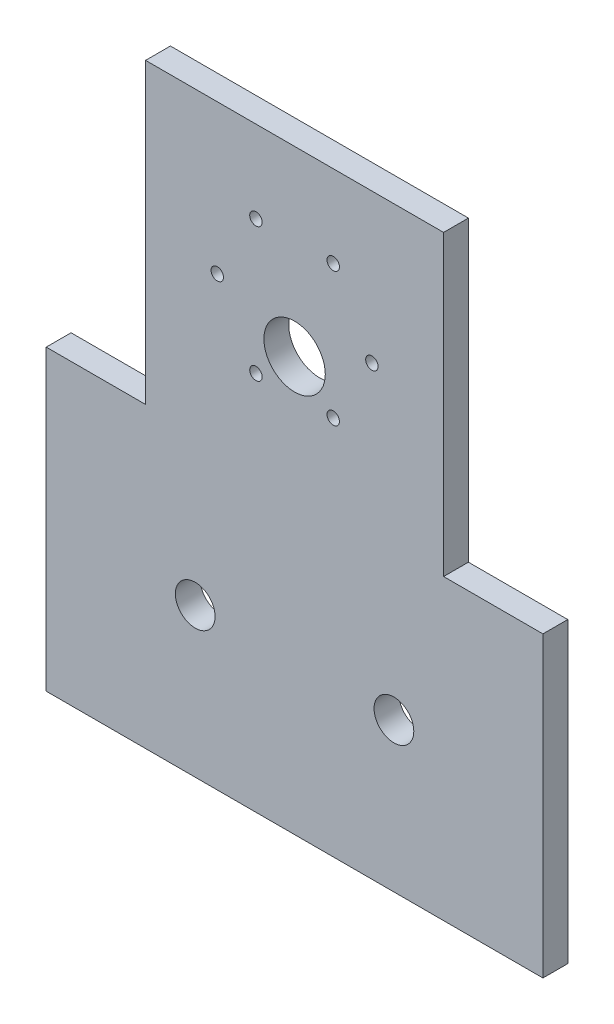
SolidWorks part; units mm, degrees
ref_plane "Front Plane" through (0, 0, 0) normal (0, 0, 1) x (1, 0, 0)
ref_plane "Top Plane" through (0, 0, 0) normal (0, 1, 0) x (1, 0, 0)
ref_plane "Right Plane" through (0, 0, 0) normal (1, 0, 0) x (0, 0, -1)
sketch "Sketch1" plane through (0, 0, 0) normal (0, 0, 1) x (1, 0, 0)
  line L0 (0, 30) -> (102.9942, 30) construction
  line L1 (0, 0) -> (100, 0)
  line L2 (0, 0) -> (0, 60)
  line L3 (0, 60) -> (20, 60)
  line L4 (100, 0) -> (100, 60)
  line L5 (20, 120) -> (80, 120)
  line L6 (20, 120) -> (20, 60)
  line L7 (20, 90) -> (80, 90) construction
  line L8 (80, 120) -> (80, 60)
  line L9 (50, 60) -> (50, -28.9204) construction
  line L10 (80, 60) -> (100, 60)
  line L11 (66.81, 90) -> (66.81, 105.1424)
  line L12 (68.61, 90) -> (68.61, 105.1424)
  line L13 (50, 77.17) -> (68.61, 77.17)
  line L14 (50, 71.39) -> (68.61, 71.39)
  line L15 (50, 90) -> (50, 83.35)
  circle A0 centre (30, 30) radius 4
  circle A1 centre (70, 30) radius 4
  circle A2 centre (50, 90) radius 18.61 construction
  circle A3 centre (65.56, 90) radius 1.25
  circle A4 centre (57.78, 76.5246) radius 1.25
  circle A5 centre (42.22, 76.5246) radius 1.25
  circle A6 centre (34.44, 90) radius 1.25
  circle A7 centre (42.22, 103.4754) radius 1.25
  circle A8 centre (57.78, 103.4754) radius 1.25
  circle A9 centre (50, 83.35) radius 6.18
  point P40 (50, 90)
  point P44 (0, 0)
  dimension "D6" = 8
  dimension "D8" = 8
  dimension "D10" = 37.22
  dimension "D12" = 2.5
  dimension "D15" = 12.36
  dimension "D1" = 100
  dimension "D2" = 60
  dimension "D3" = 20
  dimension "D4" = 20
  dimension "D5" = 30
  dimension "D7" = 30
  dimension "D9" = 60
  dimension "D11" = 1.8
  dimension "D14" = 5.78
  dimension "D13" = 6
extrude "Boss-Extrude1" add sketch "Sketch1" along normal blind 5
